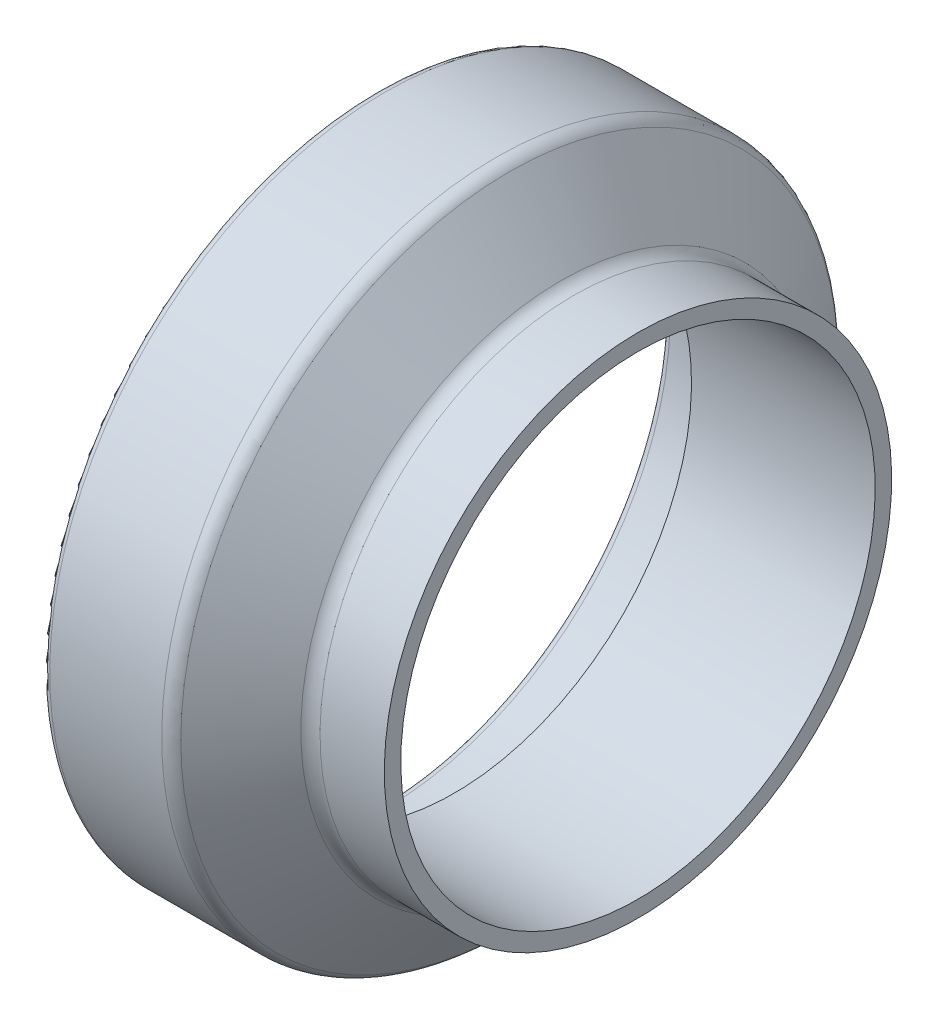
SolidWorks part; units mm, degrees
ref_plane "Front Plane" through (0, 0, 0) normal (0, 0, 1) x (1, 0, 0)
ref_plane "Top Plane" through (0, 0, 0) normal (0, 1, 0) x (1, 0, 0)
ref_plane "Right Plane" through (0, 0, 0) normal (1, 0, 0) x (0, 0, -1)
sketch "Sketch1" plane through (0, 0, 0) normal (0, 0, 1) x (1, 0, 0)
  line L0 (0, 0) -> (-52.2554, 0) construction
  line L1 (-9.6022, 23.749) -> (-27.9918, 23.749)
  line L2 (-27.9918, 23.749) -> (-27.9918, 27.8003)
  line L3 (-28.8046, 28.6131) -> (-34.9768, 28.6131)
  line L4 (-35.7896, 29.4259) -> (-35.7896, 32.7152)
  line L5 (-34.9768, 33.528) -> (-23.7604, 33.528)
  line L6 (-22.4824, 32.8908) -> (-17.3178, 26.0372)
  line L7 (-16.0399, 25.4) -> (-9.6022, 25.4)
  line L8 (-9.6022, 25.4) -> (-9.6022, 23.749)
  arc A0 (-34.9768, 33.528) -> (-35.7896, 32.7152) centre (-34.9768, 32.7152) ccw
  arc A1 (-35.7896, 29.4259) -> (-34.9768, 28.6131) centre (-34.9768, 29.4259) ccw
  arc A2 (-28.8046, 28.6131) -> (-27.9918, 27.8003) centre (-28.8046, 27.8003) cw
  arc A3 (-16.0399, 25.4) -> (-17.3178, 26.0372) centre (-16.0399, 27.0002) cw
  arc A4 (-22.4824, 32.8908) -> (-23.7604, 33.528) centre (-23.7604, 31.9278) ccw
  point P13 (-35.7896, 33.528)
  point P16 (-35.7896, 28.6131)
  point P23 (-22.9626, 33.528)
  dimension "D9" = 0.8128
  dimension "D10" = 1.6002
  dimension "D1" = 33.528
  dimension "D2" = 37
  dimension "D3" = 28.6131
  dimension "D4" = 23.749
  dimension "D5" = 12.827
  dimension "D6" = 7.7978
  dimension "D7" = 26.1874
  dimension "D8" = 25.4
revolve "Revolve1" add sketch "Sketch1" angle 360 about L0
